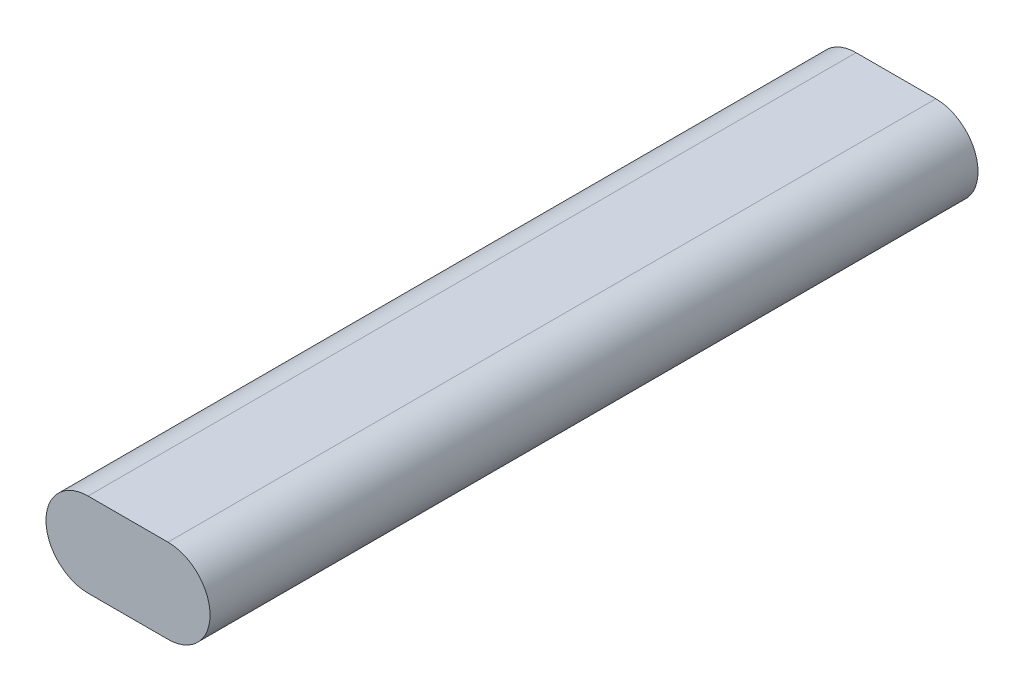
SolidWorks part; units mm, degrees
ref_plane "Front Plane" through (0, 0, 0) normal (0, 0, 1) x (1, 0, 0)
ref_plane "Top Plane" through (0, 0, 0) normal (0, 1, 0) x (1, 0, 0)
ref_plane "Right Plane" through (0, 0, 0) normal (1, 0, 0) x (0, 0, -1)
sketch "Sketch1" plane through (0, 0, 0) normal (0, 0, 1) x (1, 0, 0)
  line L0 (0, 17.399) -> (33.02, 17.399)
  line L1 (0, -17.399) -> (33.02, -17.399)
  arc A0 (0, 17.399) -> (0, -17.399) centre (0, 0) ccw
  arc A1 (33.02, -17.399) -> (33.02, 17.399) centre (33.02, 0) ccw
  dimension "D1" = 34.798
  dimension "D2" = 33.02
extrude "Boss-Extrude1" add sketch "Sketch1" along normal blind 317.5
